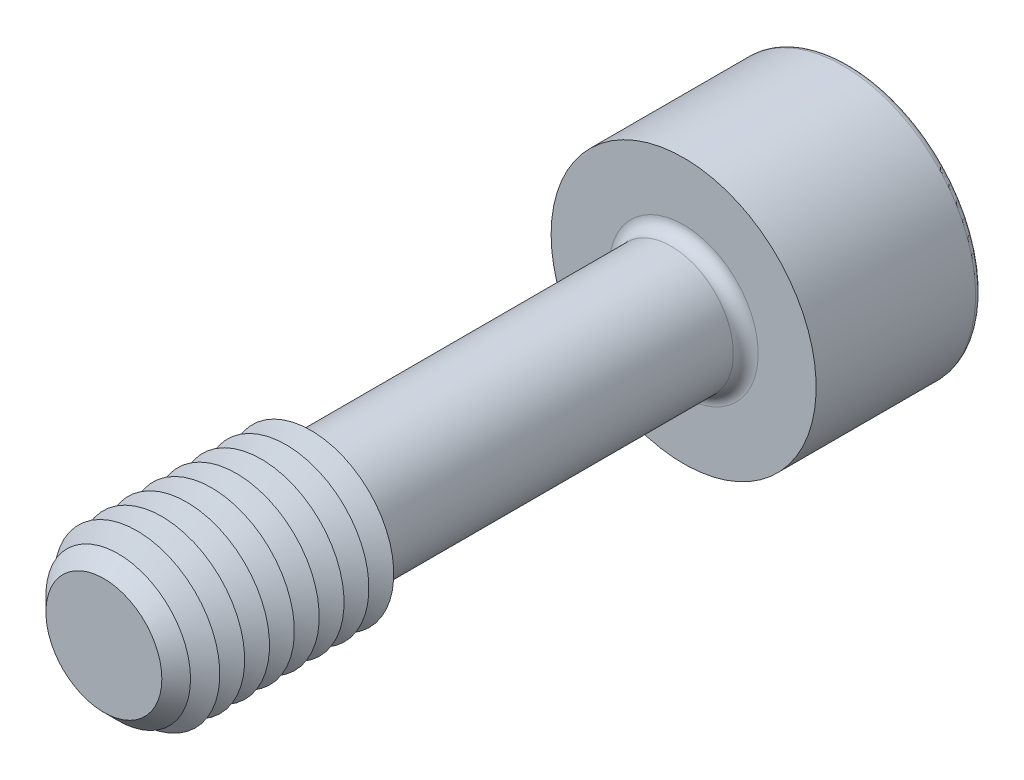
SolidWorks part; units mm, degrees
ref_plane "Front Plane" through (0, 0, 0) normal (0, 0, 1) x (1, 0, 0)
ref_plane "Top Plane" through (0, 0, 0) normal (0, 1, 0) x (1, 0, 0)
ref_plane "Right Plane" through (0, 0, 0) normal (1, 0, 0) x (0, 0, -1)
sketch "Sketch1" plane through (0, 0, 0) normal (0, 0, 1) x (1, 0, 0)
  circle A0 centre (0, 0) radius 3.75
  dimension "D1" = 7.5
extrude "Extrude1" add sketch "Sketch1" along normal mid plane 35
sketch "Sketch2" plane through (0, 0, 0) normal (1, 0, 0) x (0, 0, -1)
  line L0 (-17.5, 0) -> (-17.5, 5)
  line L1 (-17.5, 3.75) -> (-17.5, -3.75) construction
  line L2 (-17.5, 5) -> (-5, 5)
  line L3 (-5, 5) -> (-4.2783, 3.75)
  line L4 (17.5, 3.75) -> (-17.5, 3.75) construction
  line L5 (-4.2783, 3.75) -> (-4.2783, 0)
  line L6 (-4.2783, 0) -> (-17.5, 0)
  dimension "D1" = 5
  dimension "D2" = 120
  dimension "D3" = 12.5
revolve "Revolve1" add sketch "Sketch2" angle 360 about L6
chamfer "Chamfer1" distance 1.5 angle 45 1 edges at (0, 5, 17.5)
sketch "Sketch3" plane through (0, 0, -17.5) normal (0, 0, -1) x (-1, 0, 0)
  circle A0 centre (0, 0) radius 8
  dimension "D1" = 16
extrude "Extrude2" add sketch "Sketch3" along normal blind 10
sketch "Sketch4" plane through (-13.7, 0, -27.5) normal (0, 0, 1) x (1, 0, 0)
  line L2 (11.3906, -4) -> (16.0094, -4)
  line L3 (16.0094, -4) -> (18.3188, 0)
  line L4 (18.3188, 0) -> (16.0094, 4)
  line L6 (16.0094, 4) -> (11.3906, 4)
  line L7 (11.3906, 4) -> (9.0812, 0)
  line L8 (9.0812, 0) -> (11.3906, -4)
  circle A0 centre (13.7, 0) radius 4 construction
  dimension "D1" = 8
extrude "Extrude3" cut sketch "Sketch4" along normal blind 8
fillet "Fillet1" radius 0.75 1 edges at (-3.75, 0, -17.5)
fillet "Fillet2" radius 0.375 1 edges at (-8, 0, -27.5)
sketch "Sketch5" plane through (0, 0, 0) normal (1, 0, 0) x (0, 0, -1)
  line L0 (19.5, 0) -> (19.5, -4)
  line L1 (19.5, -4) -> (17.1906, 0)
  line L2 (17.1906, 0) -> (19.5, 0)
  dimension "D1" = 30
revolve "Cut-Revolve1" cut sketch "Sketch5" angle 360 about L2
sketch "Sketch6" plane through (0, 0, 0) normal (1, 0, 0) x (0, 0, -1)
  line L0 (1.332, 0) -> (-13.289, 0) construction
sketch "Sketch7" plane through (0, 0, 0) normal (1, 0, 0) x (0, 0, -1)
  line L0 (-5, 5) -> (-5.75, 3.701)
  line L1 (-5.75, 3.701) -> (-6.5, 5)
  line L2 (-5, 5) -> (-16, 5) construction
  line L3 (-6.5, 5) -> (-5, 5)
  dimension "D1" = 1.5
revolve "Cut-Revolve2" cut sketch "Sketch7" angle 360 about L0
pattern_linear "LPattern1" count 8 spacing 1.5 along (0, 0, 1) of "Cut-Revolve2"
